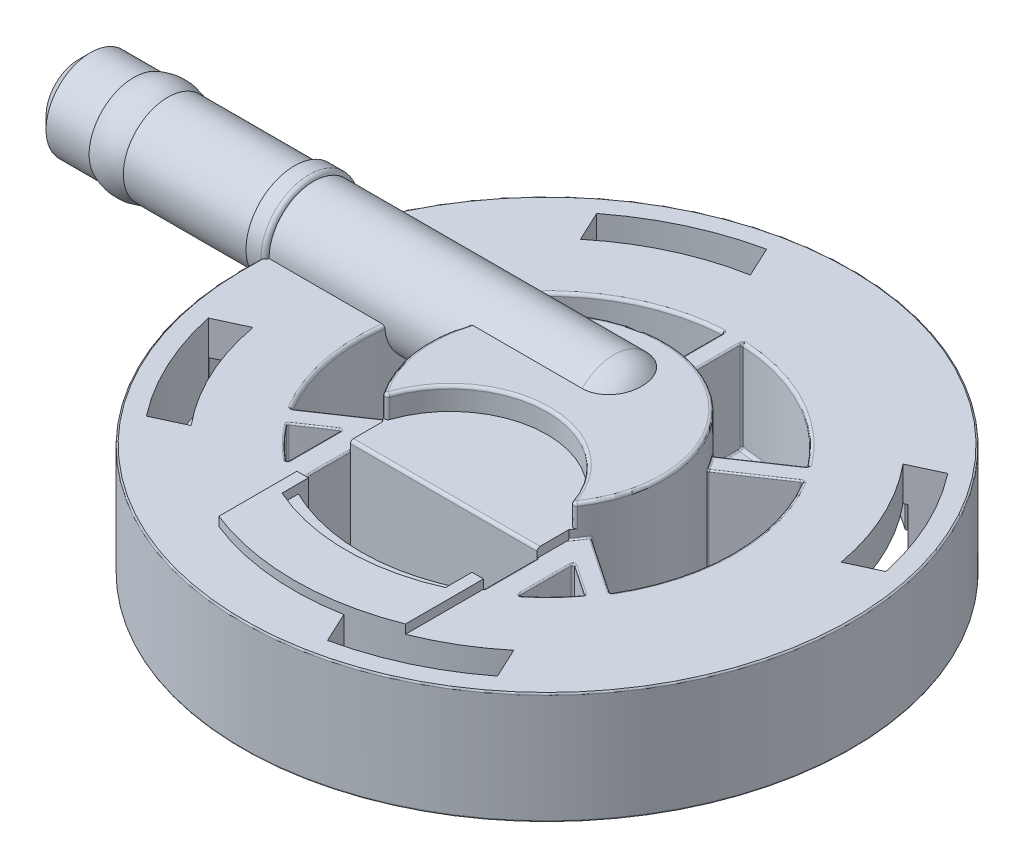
SolidWorks part; units mm, degrees
ref_plane "Plan de face" through (0, 0, 0) normal (0, 0, 1) x (1, 0, 0)
ref_plane "Plan de dessus" through (0, 0, 0) normal (0, 1, 0) x (1, 0, 0)
ref_plane "Plan de droite" through (0, 0, 0) normal (1, 0, 0) x (0, 0, -1)
sketch "Esquisse1" plane through (0, 0, 0) normal (0, 0, 1) x (1, 0, 0)
  line L0 (20.5, 0) -> (20.5, 7.5)
  line L1 (0, -17.7324) -> (0, 43.2422) construction
  line L2 (20.5, 0) -> (19.2, 0)
  line L3 (19.2, 0) -> (19.2, 5.2)
  line L4 (19.2, 5.2) -> (13.9, 5.2)
  line L5 (13.9, 5.2) -> (13.9, 0)
  line L6 (6.075, 0) -> (6.075, 7)
  line L7 (6.075, 0) -> (13.9, 0)
  line L8 (12.5, 7.5) -> (12.5, 1.3)
  line L9 (12.5, 7.5) -> (20.5, 7.5)
  line L10 (12.5, 1.3) -> (7.9, 1.3)
  line L11 (7.9, 1.3) -> (7.9, 9.6)
  line L12 (6.075, 7) -> (0, 7)
  line L13 (7.9, 9.6) -> (0, 9.6)
  line L14 (0, 9.6) -> (0, 7)
  dimension "D1" = 41
  dimension "D2" = 7.5
  dimension "D3" = 1.3
  dimension "D4" = 5.2
  dimension "D5" = 27.8
  dimension "D6" = 12.15
  dimension "D7" = 25
  dimension "D8" = 6.2
  dimension "D9" = 15.8
  dimension "D10" = 8.3
  dimension "D11" = 7
  dimension "D12" = 7.5
revolve "Révolution1" add sketch "Esquisse1" angle 360 about L1
sketch "Esquisse2" plane through (0, 7.5, 0) normal (0, 1, 0) x (-1, 0, 0)
  line L0 (0, 0) -> (0, 11.5989) construction
  line L1 (-2.4, -3.9) -> (-1.35, -3.9)
  line L2 (24, -2.55) -> (0, -2.55)
  line L5 (-9.7508, -4.5) -> (26.6008, -4.5) construction
  line L6 (24, -2.55) -> (36, -2.55)
  line L7 (0, -1.5) -> (20.2, -1.5)
  line L11 (36, -2.55) -> (36, -2.3)
  line L12 (36, -2.3) -> (35.2, -1.5)
  line L13 (32.3, -1.5) -> (35.2, -1.5)
  line L14 (21.5, -1.5) -> (30, -1.5)
  line L15 (20.4958, -1.25) -> (21.5, -1.25)
  line L16 (21.5, -1.5) -> (21.5, -1.25)
  arc A1 (32.3, -1.5) -> (30, -1.5) centre (31.15, -4.02) ccw
  arc A2 (20.2, -1.5) -> (20.4958, -1.25) centre (20.4958, -1.55) cw
  circle A3 centre (0, 0) radius 20.5 construction
  arc A4 (0, -1.5) -> (-2.4, -3.9) centre (0, -3.9) ccw
  arc A5 (0, -2.55) -> (-1.35, -3.9) centre (0, -3.9) ccw
  point P0 (-20.5, 0)
  point P13 (30, -1.5)
  point P16 (31.15, -1.25)
  point P23 (32.3, -1.5)
  point P30 (21.3197, 0.0374)
  dimension "D11" = 0.3
  dimension "D15" = 1.35
  dimension "D18" = 2.4
  dimension "D2" = 4.5
  dimension "D3" = 36
  dimension "D4" = 12
  dimension "D5" = 0.8
  dimension "D6" = 135
  dimension "D7" = 2.3
  dimension "D8" = 6
  dimension "D9" = 1.15
  dimension "D10" = 1.3
  dimension "D12" = 14.5
  dimension "D13" = 6
  dimension "D14" = 3.9
  dimension "D16" = 6.5
  dimension "D17" = 6.5
  dimension "D19" = 1.3
revolve "Révolution2" add sketch "Esquisse2" angle 360 about L5
sketch "Esquisse13" plane through (0, 5.2, 0) normal (0, -1, 0) x (1, 0, 0)
  line L0 (-13.8304, -1.3891) -> (-19.1947, -0.4528)
  line L1 (-12.017, -6.9858) -> (-14.3873, -12.714)
  arc A0 (-12.017, -6.9858) -> (-13.8304, -1.3891) centre (0, 0) cw
  circle A1 centre (0, 0) radius 13.9 construction
  arc A2 (-14.3873, -12.714) -> (-19.1947, -0.4528) centre (0, 0) cw
  circle A3 centre (0, 0) radius 19.2 construction
extrude "Enlèv. mat.-Extru.6" cut sketch "Esquisse13" along normal blind 3
sketch "Esquisse3" plane through (0, 9.6, 0) normal (0, 1, 0) x (-1, 0, 0)
  line L0 (0, 6.5) -> (0, 0) construction
  circle A0 centre (0, 6.5) radius 6.5
  dimension "D1" = 13
  dimension "D2" = 6.5
extrude "Enlèv. mat.-Extru.1" cut sketch "Esquisse3" against normal blind 1.5
sketch "Esquisse4" plane through (0, 1.3, 0) normal (0, 1, 0) x (-1, 0, 0)
  line L0 (-6.274, 4.8008) -> (-6.274, 6.95)
  line L1 (-6.274, 6.95) -> (6.274, 6.95)
  line L2 (6.274, 4.8008) -> (6.274, 6.95)
  arc A1 (-6.274, 4.8008) -> (6.274, 4.8008) centre (0, 6.5) ccw
  point P8 (0, -7.9)
  dimension "D1" = 14.85
  dimension "D2" = 6.95
extrude "Extrusion1" add sketch "Esquisse4" along normal up to surface (6.8 mm away)
sketch "Esquisse5" plane through (0, 8.1, 0) normal (0, 1, 0) x (-1, 0, 0)
  line L1 (-3.756, 6.95) -> (3.756, 6.95)
  line L2 (-3.756, 6.95) -> (-3.756, 8.6786)
  line L3 (-3.756, 8.6786) -> (3.756, 8.6786)
  line L4 (3.756, 6.95) -> (3.756, 8.6786)
extrude "Enlèv. mat.-Extru.2" cut sketch "Esquisse5" against normal up to surface (6.8 mm away)
sketch "Esquisse6" plane through (0, 1.3, 0) normal (0, 1, 0) x (-1, 0, 0)
  line L0 (-7.774, 5.9673) -> (-10.0155, 7.4793)
  line L1 (-10.6865, 6.4844) -> (-6.866, 3.9074)
  line L2 (0, 0) -> (0, 13.6306) construction
  line L3 (6.274, 4.8008) -> (6.274, 10.8114)
  line L4 (-7.774, 5.9673) -> (-7.774, 9.7885)
  line L5 (7.774, 5.9673) -> (7.774, 9.7885)
  line L6 (-6.274, 4.8008) -> (-6.274, 10.8114)
  line L7 (10.6865, 6.4844) -> (6.866, 3.9074)
  line L8 (7.774, 5.9673) -> (10.0155, 7.4793)
  line L9 (-10.223, -7.6192) -> (-5.8623, -4.6779)
  line L10 (-10.894, -6.6244) -> (-6.5334, -3.6831)
  line L13 (-0.6, -7.7267) -> (-0.6, -12.7359)
  line L15 (0.6, -7.7267) -> (0.6, -12.7359)
  arc A0 (12.4097, -1.5) -> (10, -7.5) centre (0, 0) ccw construction
  arc A1 (-10.0155, 7.4793) -> (-10.6865, 6.4844) centre (0, 0) ccw
  arc A2 (-6.274, 4.8008) -> (-6.866, 3.9074) centre (0, 0) ccw
  arc A3 (-6.274, 10.8114) -> (-7.774, 9.7885) centre (0, 0) ccw
  arc A4 (6.274, 10.8114) -> (7.774, 9.7885) centre (0, 0) cw
  arc A5 (6.274, 4.8008) -> (6.866, 3.9074) centre (0, 0) cw
  arc A6 (10.0155, 7.4793) -> (10.6865, 6.4844) centre (0, 0) cw
  arc A7 (-6.5334, -3.6831) -> (-5.8623, -4.6779) centre (0, 0) ccw
  arc A9 (-10.894, -6.6244) -> (-10.223, -7.6192) centre (0, 0) ccw
  arc A10 (0.6, -7.7267) -> (-0.6, -7.7267) centre (0, 0) cw
  arc A12 (0.6, -12.7359) -> (-0.6, -12.7359) centre (0, 0) cw
  dimension "D7" = 7.5
  dimension "D8" = 12.75
  dimension "D9" = 7.75
  dimension "D10" = 12.75
  dimension "D1" = 1.2
  dimension "D2" = 1.5
  dimension "D3" = 0.6
  dimension "D4" = 1.2
  dimension "D5" = 0.6
  dimension "D6" = 56
extrude "Extrusion2" add sketch "Esquisse6" along normal up to surface (6.2 mm away)
sketch "Esquisse7" plane through (0, 1.3, 0) normal (0, 1, 0) x (-1, 0, 0)
  line L0 (-6.274, 6.95) -> (-6.274, 10.8114) construction
  line L1 (-6.274, 10.55) -> (-5.499, 10.55)
  line L2 (-6.274, 10.55) -> (-6.274, 11.7065)
  line L3 (-6.274, 11.7065) -> (-5.499, 11.7065)
  line L4 (-5.499, 10.55) -> (-5.499, 11.7065)
  line L5 (6.274, 6.95) -> (-6.274, 6.95) construction
  line L6 (0, 0) -> (0, 11.114) construction
  line L7 (5.499, 10.55) -> (5.499, 11.7065)
  line L8 (6.274, 11.7065) -> (5.499, 11.7065)
  line L9 (6.274, 10.55) -> (6.274, 11.7065)
  line L10 (6.274, 10.55) -> (5.499, 10.55)
  dimension "D1" = 0.775
  dimension "D2" = 3.6
extrude "Extrusion4" add sketch "Esquisse7" along normal up to surface (6.8 mm away)
sketch "Esquisse8" plane through (0, 7.5, 0) normal (0, 1, 0) x (-1, 0, 0)
  line L1 (-6.274, 11.7065) -> (-5.499, 11.7065)
  line L2 (-6.274, 11.7065) -> (-6.274, 15.7999)
  line L4 (-5.499, 11.7065) -> (-5.499, 12.3293)
  line L5 (5.499, 11.7065) -> (6.274, 11.7065)
  line L6 (5.499, 11.7065) -> (5.499, 12.3293)
  line L8 (6.274, 11.7065) -> (6.274, 15.7999)
  arc A0 (-6.274, 15.7999) -> (6.274, 15.7999) centre (0, 0) cw
  arc A2 (-5.499, 12.3293) -> (5.499, 12.3293) centre (0, 0) cw
  dimension "D1" = 17
  dimension "D4" = 13.5
extrude "Extrusion5" add sketch "Esquisse8" along normal up to surface (0.6 mm away)
sketch "Esquisse9" plane through (0, 1.3, 0) normal (0, -1, 0) x (1, 0, 0)
  circle A0 centre (0, 0) radius 6.075
extrude "Enlèv. mat.-Extru.3" cut sketch "Esquisse9" against normal up to surface (5.7 mm away)
sketch "Esquisse10" plane through (0, 7, 0) normal (0, -1, 0) x (1, 0, 0)
  line L1 (2, -2) -> (-5.7363, -2)
  line L2 (2, -2) -> (2, -5.7363)
  arc A0 (-5.7363, -2) -> (2, -5.7363) centre (0, 0) ccw
  circle A1 centre (0, 0) radius 6.075 construction
  dimension "D1" = 2
  dimension "D2" = 2
extrude "Enlèv. mat.-Extru.4" cut sketch "Esquisse10" against normal blind 0.6
sketch "Esquisse11" plane through (-36, 0, 0) normal (-1, 0, 0) x (0, 0, 1)
  line L0 (-2.55, 7.5) -> (-6.45, 7.5) construction
  circle A0 centre (-4.5, 7.5) radius 1.95
  dimension "D1" = 3.9
extrude "Enlèv. mat.-Extru.5" cut sketch "Esquisse11" against normal blind 37.5
ref_plane "Plan1" through (0, 0.6, 0) normal (0, -1, 0) x (1, 0, 0)
sketch "Esquisse12" plane through (0, 0.6, 0) normal (0, -1, 0) x (1, 0, 0)
  line L0 (16.8586, -4) -> (18.7787, -4)
  line L1 (12.6995, -11.8243) -> (14.0801, -13.0534)
  line L2 (10.1727, -14.0436) -> (11.3959, -15.4523)
  line L4 (5.8272, -16.3192) -> (6.8399, -17.9403)
  line L5 (10.3241, -16.188) -> (9.1086, -14.7853)
  line L6 (4.3729, -16.7868) -> (4.7913, -18.5926)
  arc A0 (14.0801, -13.0534) -> (18.7787, -4) centre (0, 0) ccw
  arc A1 (12.6924, -11.6819) -> (16.7614, -4.0764) centre (0, 0) ccw
  circle A2 centre (0, 0) radius 19.2 construction
  arc A3 (10.3241, -16.188) -> (11.3959, -15.4523) centre (0, 0) ccw
  arc A4 (9.1313, -14.635) -> (10.039, -14.0278) centre (0, 0) ccw
  arc A5 (4.4446, -16.6676) -> (5.7093, -16.2778) centre (0, 0) ccw
  arc A6 (4.7913, -18.5926) -> (6.8399, -17.9403) centre (0, 0) ccw
  arc A7 (5.8272, -16.3192) -> (5.7093, -16.2778) centre (5.7424, -16.3722) ccw
  arc A8 (4.3729, -16.7868) -> (4.4446, -16.6676) centre (4.4703, -16.7642) cw
  arc A9 (9.1086, -14.7853) -> (9.1313, -14.635) centre (9.1842, -14.7198) cw
  arc A10 (10.1727, -14.0436) -> (10.039, -14.0278) centre (10.0972, -14.1092) ccw
  arc A11 (12.6995, -11.8243) -> (12.6924, -11.6819) centre (12.7659, -11.7496) cw
  arc A12 (16.8586, -4) -> (16.7614, -4.0764) centre (16.8586, -4.1) ccw
  point P17 (5.7847, -16.2511)
  point P21 (4.351, -16.6922)
  point P24 (9.0318, -14.6966)
  point P27 (10.1129, -13.9747)
  point P30 (12.6233, -11.7565)
  point P33 (16.7798, -4)
  dimension "D1" = 34.5
  dimension "D5" = 1.5
  dimension "D13" = 0.1
  dimension "D2" = 8.8
  dimension "D3" = 4
  dimension "D4" = 10.2
  dimension "D6" = 2.15
  dimension "D7" = 3.9
  dimension "D8" = 3.6
  dimension "D9" = 3.35
  dimension "D10" = 3.6
  dimension "D11" = 1.3
  dimension "D12" = 1.3
extrude "Extrusion6" add sketch "Esquisse12" against normal up to surface (4.6 mm away)
pattern_circular "Répétition circulaire3" count 4 over 360 about axis through (0, 0, 0) along (0, 1, 0) of "Extrusion6"
sketch "Esquisse14" plane through (0, 0, 0) normal (0, -1, 0) x (1, 0, 0)
  line L1 (0.95, 13.8675) -> (-0.95, 13.8675)
  line L2 (0.95, 13.8675) -> (0.95, 7.2175)
  line L3 (0.95, 7.2175) -> (-0.95, 7.2175)
  line L4 (-0.95, 13.8675) -> (-0.95, 7.2175)
  circle A0 centre (0, 0) radius 13.9 construction
  dimension "D1" = 0.95
  dimension "D2" = 1.9
  dimension "D3" = 6.65
  dimension "D4" = 13.8675
extrude "Extrusion7" add sketch "Esquisse14" along normal blind 1.9
pattern_circular "Répétition circulaire4" count 3 over 360 about axis through (0, 0, 0) along (0, 1, 0) of "Extrusion7"
sketch "Esquisse15" plane through (0, 7.5, 0) normal (0, 1, 0) x (-1, 0, 0)
  line L0 (18.7764, 4.011) -> (16.7235, 3.0538)
  line L1 (0, 0) -> (29.5633, 13.7856) construction
  line L2 (36, -4.5) -> (-1.5, -4.5) construction
  line L3 (15.1418, 11.8053) -> (13.089, 10.848)
  arc A0 (18.7764, 4.011) -> (15.1418, 11.8053) centre (0, 0) ccw
  arc A1 (16.7235, 3.0538) -> (13.089, 10.848) centre (0, 0) ccw
  arc A2 (6.274, 15.7999) -> (-6.274, 15.7999) centre (0, 0) ccw construction
  arc A3 (4.7913, 18.5926) -> (-4, 18.7787) centre (0, 0) ccw construction
  point P7 (0, 17)
  point P8 (0, 19.2)
  dimension "D1" = 25
  dimension "D2" = 4.3
extrude "Enlèv. mat.-Extru.7" cut sketch "Esquisse15" against normal blind 4.9
pattern_circular "Répétition circulaire5" count 4 over 360 about axis through (0, 0, 0) along (0, 1, 0) of "Enlèv. mat.-Extru.7"
fillet "Congé4" radius 0.1 3 edges at (20.0156, 7.5, 4.4303) (0, 0, -20.5) (0, 0, -6.075)
fillet "Congé5" radius 0.2 3 edges at (-7.7793, 9.6, 1.3759) (5.8081, 9.6, -5.355) (0, 9.6, 0)
fillet "Congé6" radius 0.2 7 edges at (-6.9753, 1.3, -3.7088) (3.7088, 1.3, -6.9753) (7.9, 1.3, 0) (5.8684, 7.5, -11.0368) (-5.857, 7.5, -11.0429) (-12.2187, 7.5, 2.6369) (0, 8.1, 6.95)
fillet "Congé7" radius 0.2 4 edges at (12.5, 1.3, 0) (5.8684, 1.3, -11.0368) (-11.0368, 1.3, -5.8684) (12.5, 7.5, 0)
fillet "Congé8" radius 0.2 4 edges at (-6.2789, 9.4666, 4.7755) (6.2789, 9.4666, 4.7755) (6.274, 8.75, 4.8008) (-6.274, 8.75, 4.8008)
fillet "Congé9" radius 0.2 3 edges at (-8.9694, 1.3, 8.7063) (-8.8947, 1.3, 6.7233) (-7.774, 1.3, 7.8779)
fillet "Congé10" radius 0.1 6 edges at (-7.8325, 1.3586, 6.0775) (-9.9799, 1.4034, 7.4853) (-7.785, 1.4346, 9.7657) (-7.774, 4.5, 5.9673) (-10.0155, 4.5, 7.4793) (-7.774, 4.5, 9.7885)
fillet "Congé11" radius 0.1 6 edges at (-7.8312, 7.5, 9.6696) (-7.774, 7.5, 7.8673) (-7.827, 7.5, 6.0671) (-8.929, 7.5, 6.7464) (-9.9709, 7.5, 7.487) (-9.0056, 7.5, 8.6688)
fillet "Congé12" radius 0.2 3 edges at (8.9694, 1.3, 8.7063) (7.774, 1.3, 7.8779) (8.8947, 1.3, 6.7233)
fillet "Congé13" radius 0.1 6 edges at (7.8325, 1.3586, 6.0775) (9.9799, 1.4034, 7.4853) (7.785, 1.4346, 9.7657) (7.774, 4.5, 5.9673) (10.0155, 4.5, 7.4793) (7.774, 4.5, 9.7885)
fillet "Congé14" radius 0.1 6 edges at (9.9709, 7.5, 7.487) (8.929, 7.5, 6.7464) (7.827, 7.5, 6.0671) (7.774, 7.5, 7.8673) (7.8312, 7.5, 9.6696) (9.0056, 7.5, 8.6688)
fillet "Congé15" radius 0.1 36 edges at (-0.6, 7.4561, -12.5606) (-0.6, 4.4, -12.4856) (-0.6, 1.3752, -12.4418) (-0.6, 4.5, -7.8772) (-0.6, 1.344, -7.9522) (10.0777, 7.4561, -7.5212) (10.0155, 4.4, -7.4793) (9.9792, 1.3752, -7.4548) (6.195, 4.5, -4.9023) (6.2572, 1.344, -4.9442) (0.6, 4.5, -7.8772) (0.6, 1.3753, -7.9209) (0.6, 7.4248, -12.5294) (0.6, 4.4, -12.4856) (0.6, 1.3439, -12.4106) (6.866, 4.5, -3.9074) (6.9023, 1.3753, -3.9319) (10.7228, 7.4248, -6.5089) (10.6865, 4.4, -6.4844) (10.6243, 1.3439, -6.4425) (-10.7228, 7.4248, 6.5089) (-6.866, 4.5, 3.9074) (-6.9023, 1.3753, 3.9319) (-8.7764, 1.3, 5.196) (-10.6243, 1.3439, 6.4425) (10.7488, 7.4561, 6.5264) (6.866, 4.5, 3.9074) (6.9282, 1.344, 3.9494) (8.7764, 1.3, 5.196) (10.6502, 1.3752, 6.4599) (-0.6, 1.3, -10.1816) (8.1054, 1.3, -6.1909) (0.6, 1.3, -10.1816) (8.7764, 1.3, -5.196) (-10.6865, 4.4, 6.4844) (10.6865, 4.4, 6.4844)
fillet "Congé16" radius 0.1 24 edges at (-6.9011, 7.5, 3.8994) (-10.7268, 7.5, 6.4972) (-0.6119, 7.5, -12.5261) (-0.6263, 7.5, -7.9018) (0.6263, 7.5, -7.9018) (0.6119, 7.5, -12.5261) (10.0424, 7.5, -7.5118) (6.2007, 7.5, -4.9378) (6.9011, 7.5, -3.8994) (10.7268, 7.5, -6.4972) (10.7268, 7.5, 6.4972) (6.9011, 7.5, 3.8994) (-6.6103, 7.5, 4.3259) (6.6103, 7.5, 4.3259) (0, 7.5, -7.9) (6.5494, 7.5, -4.4176) (6.274, 7.5, 8.75) (-6.274, 7.5, 8.75) (-8.8025, 7.5, 5.2136) (-0.6, 7.5, -10.213) (0.6, 7.5, -10.213) (8.1315, 7.5, -6.2085) (8.8025, 7.5, -5.2136) (8.8025, 7.5, 5.2136)
